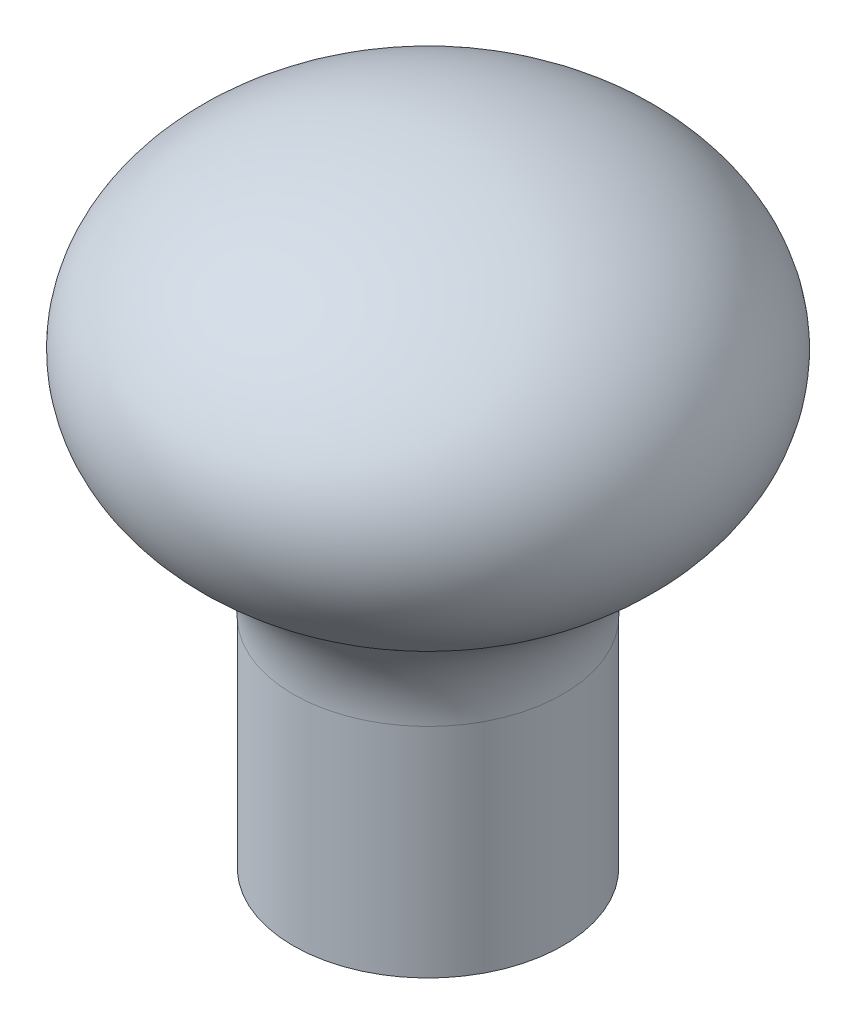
SolidWorks part; units mm, degrees
ref_plane "Front Plane" through (0, 0, 0) normal (0, 0, 1) x (1, 0, 0)
ref_plane "Top Plane" through (0, 0, 0) normal (0, 1, 0) x (1, 0, 0)
ref_plane "Right Plane" through (0, 0, 0) normal (1, 0, 0) x (0, 0, -1)
sketch "Sketch1" plane through (0, 0, 0) normal (0, 0, 1) x (1, 0, 0)
  line L0 (0, -55) -> (0, 55) construction
  line L1 (55, 0) -> (-55, 0) construction
  line L2 (7.5, 0) -> (7.5, 16.3397)
  line L3 (0, 35) -> (0, 0)
  line L4 (0, 0) -> (7.5, 0)
  line L5 (0, 0) -> (0, 51.4147) construction
  ellipse E0 centre (0, 25) end of major axis (-15, 25) minor radius 10 (7.5, 16.3397) -> (0, 35) ccw
  point P2 (0, 51.4147)
  dimension "D1" = 30
  dimension "D2" = 25
  dimension "D3" = 35
  dimension "D4" = 7.5
revolve "Revolve1" add sketch "Sketch1" angle 360 about L5
fillet "Fillet1" radius 7 1 edges at (0, 16.3397, -7.5)
